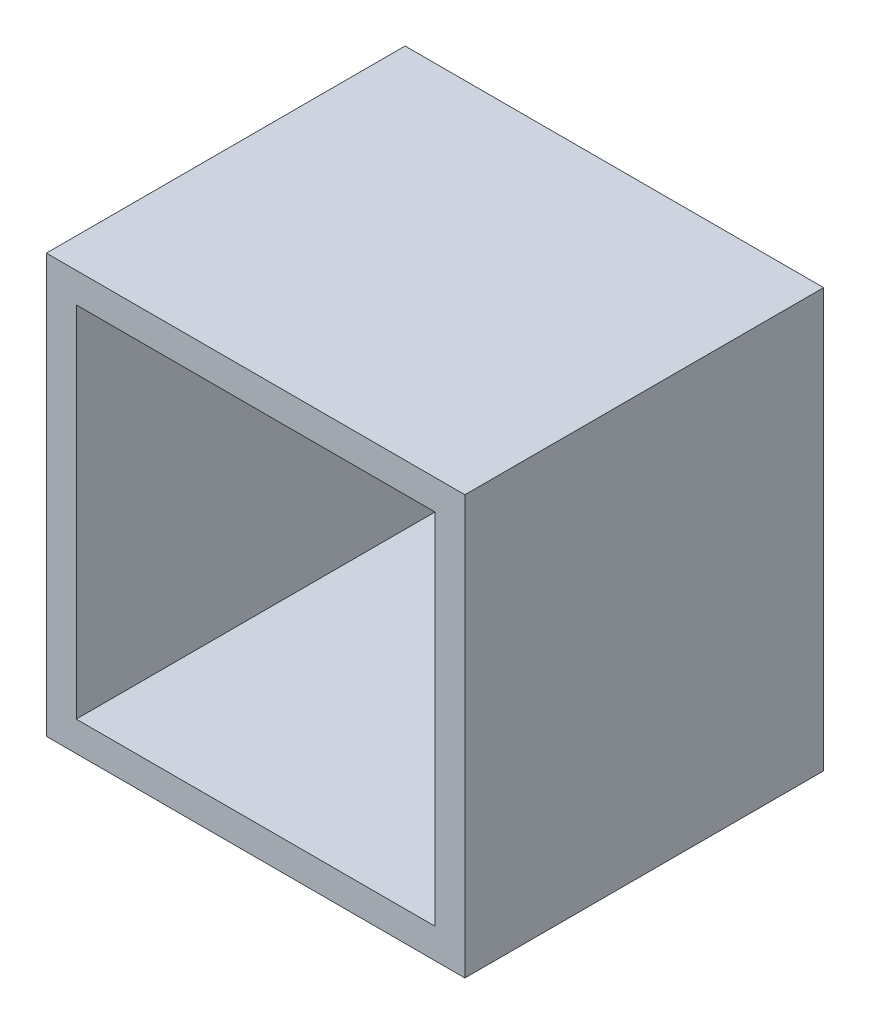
SolidWorks part; units mm, degrees
ref_plane "Front Plane" through (0, 0, 0) normal (0, 0, 1) x (1, 0, 0)
ref_plane "Top Plane" through (0, 0, 0) normal (0, 1, 0) x (1, 0, 0)
ref_plane "Right Plane" through (0, 0, 0) normal (1, 0, 0) x (0, 0, -1)
sketch "Sketch2" plane through (0, 0, 0) normal (0, 0, 1) x (1, 0, 0)
  line L1 (-177.8, 177.8) -> (177.8, 177.8)
  line L2 (-177.8, 177.8) -> (-177.8, -177.8)
  line L3 (-177.8, -177.8) -> (177.8, -177.8)
  line L4 (177.8, 177.8) -> (177.8, -177.8)
  line L5 (-177.8, 177.8) -> (177.8, -177.8) construction
  line L6 (-177.8, -177.8) -> (177.8, 177.8) construction
  line L7 (-152.4, 152.4) -> (152.4, 152.4)
  line L8 (-152.4, 152.4) -> (-152.4, -152.4)
  line L9 (-152.4, -152.4) -> (152.4, -152.4)
  line L10 (152.4, 152.4) -> (152.4, -152.4)
  line L11 (-152.4, 152.4) -> (152.4, -152.4) construction
  line L12 (-152.4, -152.4) -> (152.4, 152.4) construction
  point P0 (0, 0)
  point P6 (0, 0)
  dimension "D1" = 355.6
  dimension "D2" = 355.6
  dimension "D3" = 304.8
extrude "Extrude1" add sketch "Sketch2" along normal blind 304.8
